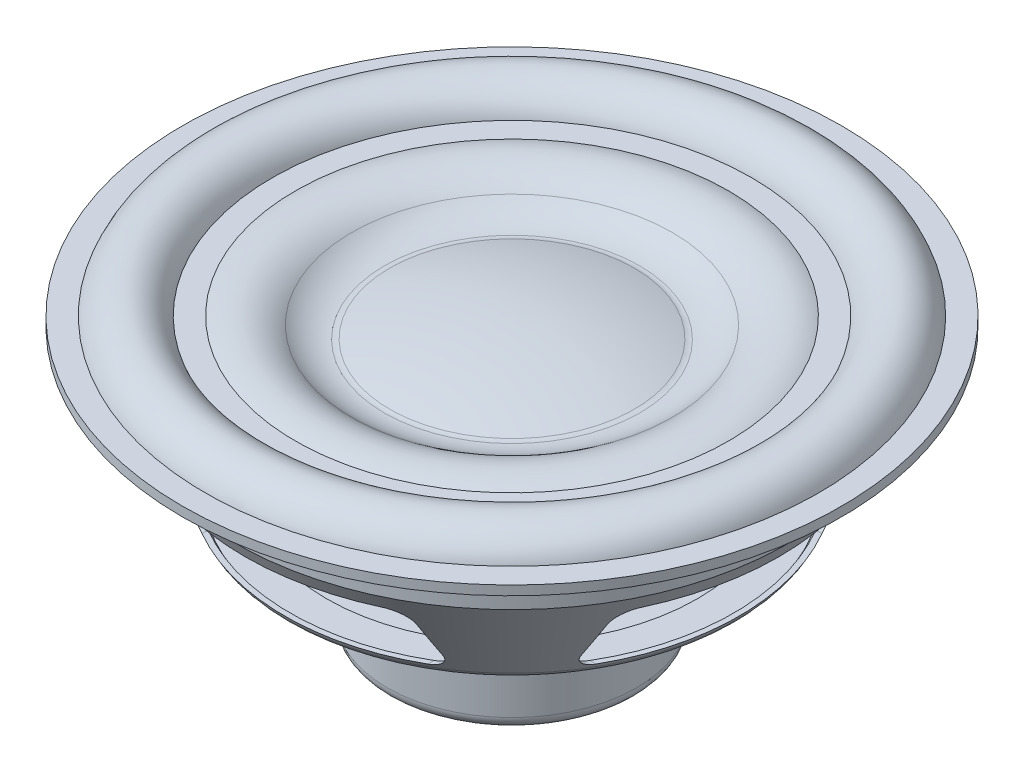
SolidWorks part; units mm, degrees
ref_plane "Front Plane" through (0, 0, 0) normal (0, 0, 1) x (1, 0, 0)
ref_plane "Top Plane" through (0, 0, 0) normal (0, 1, 0) x (1, 0, 0)
ref_plane "Right Plane" through (0, 0, 0) normal (1, 0, 0) x (0, 0, -1)
sketch "Sketch6" plane through (0, 0, 0) normal (0, 0, 1) x (1, 0, 0)
  line L0 (-22.479, -3.048) -> (-22.479, -4.318)
  line L2 (0, 0) -> (0, 7.5869) construction
  line L5 (0, -21.2852) -> (-9.779, -21.2852)
  line L6 (-22.479, -3.048) -> (0, -3.048)
  line L7 (0, -21.6662) -> (-10.16, -21.6662)
  line L8 (-10.16, -21.6662) -> (-10.16, -14.3002)
  line L9 (-10.16, -14.3002) -> (-15.494, -14.3002)
  line L10 (-15.494, -14.3002) -> (-15.494, -12.2682)
  line L11 (-15.494, -12.2682) -> (-18.034, -12.2682)
  line L12 (-18.034, -12.2682) -> (-22.479, -4.318)
  line L15 (-9.779, -21.2852) -> (-9.779, -13.9192)
  line L16 (-9.779, -13.9192) -> (-15.113, -13.9192)
  line L17 (-15.113, -13.9192) -> (-15.113, -11.8872)
  line L18 (-15.113, -11.8872) -> (-17.8105, -11.8872)
  line L19 (-17.8105, -11.8872) -> (-22.098, -4.2187)
  line L20 (-22.098, -3.429) -> (-22.098, -4.2187)
  line L21 (-22.098, -3.429) -> (0, -3.429)
  line L22 (0, -3.048) -> (0, -3.429)
  line L23 (0, -21.6662) -> (0, -21.2852)
  dimension "D2" = 20.32
  dimension "D4" = 30.988
  dimension "D5" = 36.068
  dimension "D7" = 1.27
  dimension "D8" = 0.381
revolve "Revolve1" add sketch "Sketch6" angle 360 about L2
fillet "Fillet1" radius 1.016 3 edges at (0, -14.3002, -15.494) (0, -12.2682, -18.034) (0, -21.6662, -10.16)
sketch "Sketch7" plane through (0, 0, 0) normal (0, 0, -1) x (-1, 0, 0)
  line L0 (0, -5.588) -> (0, -8.5027) construction
  line L3 (9.2075, -11.4173) -> (-9.2075, -11.4173)
  line L4 (10.4775, -10.1473) -> (10.4775, -6.858)
  line L5 (9.2075, -5.588) -> (-9.2075, -5.588)
  line L6 (-10.4775, -10.1473) -> (-10.4775, -6.858)
  line L7 (10.4775, -11.4173) -> (-10.4775, -5.588) construction
  line L8 (10.4775, -5.588) -> (-10.4775, -11.4173) construction
  arc A0 (9.2075, -5.588) -> (10.4775, -6.858) centre (9.2075, -6.858) cw
  arc A1 (10.4775, -10.1473) -> (9.2075, -11.4173) centre (9.2075, -10.1473) cw
  arc A2 (-9.2075, -11.4173) -> (-10.4775, -10.1473) centre (-9.2075, -10.1473) cw
  arc A3 (-9.2075, -5.588) -> (-10.4775, -6.858) centre (-9.2075, -6.858) ccw
  dimension "D3" = 1.27
  dimension "D1" = 20.955
  dimension "D2" = 5.8293
extrude "Cut-Extrude3" cut sketch "Sketch7" against normal through all
pattern_circular "CirPattern1" count 4 over 360 about axis through (0, 0, 0) along (0, 1, 0) of "Cut-Extrude3"
dome "Dome1" faces to dome 2 distance 6.35 parameters "D1"=6.35
sketch "Sketch8" plane through (0, 0, 0) normal (0, 0, 1) x (1, 0, 0)
  line L0 (0, -21.6662) -> (0, 2.4638) construction
  line L1 (-9.144, -21.6662) -> (9.144, -21.6662) construction
  line L2 (0, 2.4638) -> (-28.5145, 2.4638) construction
  line L3 (-26.8605, -0.2413) -> (-24.9936, -0.2413)
  line L4 (-26.8605, -0.2413) -> (-26.8605, 0.5207)
  line L5 (-26.8605, 0.5207) -> (-24.9936, 0.5207)
  line L6 (-24.9936, 0.5207) -> (-19.5263, 0.5207)
  line L7 (-10.16, -1.1429) -> (0, -1.1429) construction
  line L8 (0, -1.1429) -> (10.16, -1.1429) construction
  line L9 (-19.5263, 0.5207) -> (-17.6593, 0.5207)
  line L12 (0, -3.048) -> (-22.479, -3.048)
  line L13 (22.479, -3.048) -> (-22.479, -3.048) construction
  line L14 (0, -3.048) -> (0, 0.3811)
  line L15 (-22.479, -3.048) -> (-22.479, -4.318) construction
  line L16 (-24.845, -0.682) -> (-22.5002, -0.682) construction
  arc A0 (-22.479, -3.048) -> (-23.9872, -0.843) centre (-24.845, -3.048) ccw
  arc A1 (-24.9936, 0.5207) -> (-19.5263, 0.5207) centre (-22.2599, -0.4307) cw
  arc A2 (-9.9681, -1.0846) -> (0, 0.3811) centre (0, -34.2476) cw
  arc A3 (0, 0.3811) -> (10.16, -1.1429) centre (0, -34.2476) cw construction
  arc A4 (-10.3998, -1.1367) -> (-13.0622, -0.1148) centre (-10.16, 3.4671) cw
  arc A5 (-13.0622, -0.1148) -> (-17.6593, 0.5207) centre (-15.8865, -3.6006) ccw
  arc A6 (-24.9936, -0.2413) -> (-24.8238, -0.3095) centre (-24.9936, -0.4867) cw
  arc A7 (-23.9872, -0.843) -> (-24.8238, -0.3095) centre (-23.0662, 1.5242) cw
  arc A8 (-10.3998, -1.1367) -> (-9.9681, -1.0846) centre (-10.3337, 0.1316) ccw
  dimension "D9" = 2.54
  dimension "D10" = 1.27
  dimension "D1" = 24.13
  dimension "D2" = 0.762
  dimension "D3" = 49.9872
  dimension "D4" = 53.721
  dimension "D5" = 2.7051
  dimension "D6" = 1.524
  dimension "D7" = 20.32
  dimension "D8" = 39.0525
revolve "Revolve2" add sketch "Sketch8" angle 360 about L0
